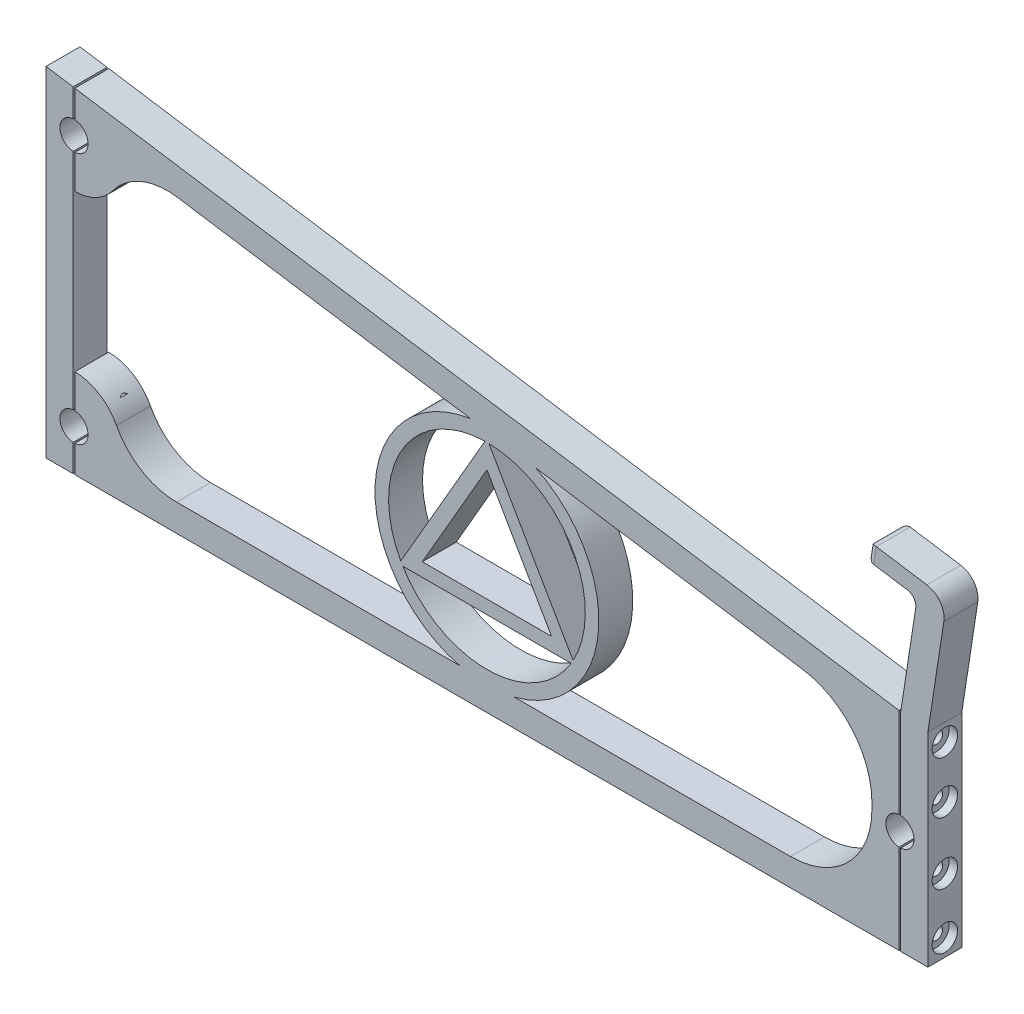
SolidWorks part; units mm, degrees
ref_plane "Front Plane" through (0, 0, 0) normal (0, 0, 1) x (1, 0, 0)
ref_plane "Top Plane" through (0, 0, 0) normal (0, 1, 0) x (1, 0, 0)
ref_plane "Right Plane" through (0, 0, 0) normal (1, 0, 0) x (0, 0, -1)
sketch "Sketch1" plane through (0, 0, 0) normal (0, 0, 1) x (1, 0, 0)
  line L0 (0, 0) -> (0, 100)
  line L1 (0, 100) -> (8, 98.7692)
  line L2 (260, 60) -> (260, 0)
  line L3 (260, 0) -> (252, 0)
  line L4 (130, 0) -> (130, 80) construction
  line L7 (243.5, 8) -> (21.7777, 8)
  line L9 (251.5, 0) -> (251.5, 26.4259)
  line L10 (252, 0) -> (252, 26.4259)
  line L11 (243.5, 54.4443) -> (243.5, 8)
  line L12 (251.5, 34.7108) -> (251.5, 61.3077)
  line L13 (252, 61.2308) -> (252, 34.7108)
  line L14 (8, 90.6751) -> (252, 53.1366) construction
  line L15 (252, 61.2308) -> (256.8658, 92.8587)
  line L16 (252, 53.1366) -> (252, 8) construction
  line L18 (264.5617, 89.6512) -> (260, 60)
  line L19 (256.8658, 92.8587) -> (242.0403, 95.1395)
  line L20 (252, 8) -> (8, 8) construction
  line L21 (251.5, 0) -> (8.5, 0)
  line L22 (260, 0) -> (0, 0) construction
  line L24 (0, 100) -> (260, 60) construction
  line L25 (242.0403, 95.1395) -> (242.8005, 100.0814)
  line L26 (242.8005, 100.0814) -> (265.6261, 96.5698)
  line L27 (265.6261, 96.5698) -> (264.5617, 89.6512)
  line L28 (8.5, 90.5906) -> (8.5, 98.6923)
  line L31 (8, 90.5906) -> (8, 98.7692)
  line L32 (8, 8) -> (8, 90.6751) construction
  line L33 (22.253, 88.4823) -> (243.5, 54.4443)
  line L34 (8.25, 12.15) -> (14.6026, 12.15) construction
  line L35 (8, 82.3057) -> (8, 16.2925)
  line L38 (8, 0) -> (0, 0)
  line L39 (8.5, 72.3004) -> (8.5, 82.3057)
  line L40 (8.5, 0) -> (8.5, 8.0075)
  line L41 (8.5, 98.6923) -> (251.5, 61.3077)
  line L42 (8.5, 16.2925) -> (8.5, 26.2978)
  line L43 (8, 8.0075) -> (8, 0)
  line L44 (8.25, 12.15) -> (251.5, 61.3077) construction
  arc A0 (251.5, 34.7108) -> (251.5, 26.4259) centre (251.75, 30.5683) ccw
  arc A1 (252, 26.4259) -> (252, 34.7108) centre (251.75, 30.5683) ccw
  arc A3 (8, 90.5906) -> (8, 82.3057) centre (8.25, 86.4482) ccw
  arc A4 (8.5, 82.3057) -> (8.5, 90.5906) centre (8.25, 86.4482) ccw
  arc A5 (22.253, 88.4823) -> (8.5, 72.3004) centre (8.25, 86.4482) cw
  arc A7 (21.7777, 8) -> (8.5, 26.2978) centre (8.25, 12.15) ccw
  arc A9 (8.5, 8.0075) -> (8.5, 16.2925) centre (8.25, 12.15) ccw
  arc A10 (8, 16.2925) -> (8, 8.0075) centre (8.25, 12.15) ccw
  dimension "D6" = 15
  dimension "D8" = 32
  dimension "D1" = 100
  dimension "D2" = 60
  dimension "D3" = 260
  dimension "D5" = 30
  dimension "D7" = 5
  dimension "D4" = 8
extrude "Boss-Extrude1" add sketch "Sketch1" along normal mid plane 10
fillet "Fillet1" radius 20 2 edges at (21.7777, 8, 0) (22.253, 88.4823, 0)
fillet "Fillet2" radius 24 2 edges at (243.5, 8, 0) (243.5, 54.4443, 0)
fillet "Fillet3" radius 3 1 edges at (256.8658, 92.8587, 0)
fillet "Fillet4" radius 6 1 edges at (265.6261, 96.5698, 0)
fillet "Fillet5" radius 2 4 edges at (242.8005, 100.0814, 0) (242.4204, 97.6105, 5) (242.0403, 95.1395, 0) (242.4204, 97.6105, -5)
ref_plane "Plane1" through (260, 0, 0) normal (1, 0, 0) x (0, 0, -1)
sketch "Sketch2" plane through (0, 0, 0) normal (0, 0, 1) x (1, 0, 0)
  line L0 (130, 0) -> (130, 80) construction
  line L1 (8.5, 0) -> (251.5, 0) construction
  line L2 (251.5, 61.3077) -> (8.5, 98.6923) construction
  line L3 (130, 62) -> (110.9474, 29)
  line L4 (129.4193, 68.9942) -> (104.5999, 26.0058)
  line L5 (105.1807, 25) -> (154.8193, 25)
  line L6 (155.4001, 26.0058) -> (130.5807, 68.9942)
  line L7 (110.9474, 29) -> (149.0526, 29)
  line L8 (149.0526, 29) -> (130, 62)
  line L9 (130, 70) -> (104.0192, 25) construction
  line L10 (155.9808, 25) -> (130, 70) construction
  line L11 (104.0192, 25) -> (155.9808, 25) construction
  circle A0 centre (130, 40) radius 33
  arc A1 (129.4193, 68.9942) -> (104.5999, 26.0058) centre (130, 40) ccw
  circle A2 centre (130, 40) radius 15 construction
  circle A3 centre (130, 40) radius 29 construction
  arc A4 (155.4001, 26.0058) -> (130.5807, 68.9942) centre (130, 40) ccw
  arc A5 (105.1807, 25) -> (154.8193, 25) centre (130, 40) ccw
  dimension "D1" = 4
  dimension "D2" = 4
extrude "Boss-Extrude2" add sketch "Sketch2" along normal mid plane 10
sketch "Sketch3" plane through (0, 0, 0) normal (1, 0, 0) x (0, 0, -1)
  line L2 (-5, 72.3004) -> (5, 72.3004) construction
  line L3 (-5, 16.2925) -> (5, 16.2925) construction
  line L4 (-5, 8.0075) -> (5, 8.0075) construction
  line L5 (-5, 26.2978) -> (5, 26.2978) construction
  line L6 (-5, 82.3057) -> (5, 82.3057) construction
  line L7 (-5, 90.5906) -> (5, 90.5906) construction
  line L8 (-5, 72.3004) -> (5, 72.3004) construction
  line L9 (-5, 90.5906) -> (5, 90.5906) construction
  line L10 (-5, 82.3057) -> (5, 82.3057) construction
  line L11 (-5, 26.2978) -> (5, 26.2978) construction
  line L12 (-5, 8.0075) -> (5, 8.0075) construction
  line L13 (-5, 16.2925) -> (5, 16.2925) construction
  line L16 (0, 90.5906) -> (0, 82.3057) construction
  line L17 (0, 82.3057) -> (0, 72.3004) construction
  line L18 (0, 72.3004) -> (0, 26.2978) construction
  line L19 (0, 26.2978) -> (0, 16.2925) construction
  line L20 (0, 16.2925) -> (0, 8.0075) construction
  line L21 (0, 8.0075) -> (0, 0) construction
  circle A0 centre (0, 94.0906) radius 1.5
  circle A1 centre (0, 77.3031) radius 1.5
  circle A2 centre (0, 21.2951) radius 1.5
  circle A3 centre (0, 4.0038) radius 1.5
  dimension "D1" = 3
  dimension "D2" = 3.5
extrude "Cut-Extrude1" cut sketch "Sketch3" along normal blind 18
sketch "Sketch4" plane through (0, 0, 0) normal (1, 0, 0) x (0, 0, -1)
  circle A0 centre (0, 94.0906) radius 1.875
  circle A1 centre (0, 77.3031) radius 1.875
  circle A2 centre (0, 21.2951) radius 1.875
  circle A3 centre (0, 4.0038) radius 1.875
  dimension "D1" = 3.75
extrude "Cut-Extrude2" cut sketch "Sketch4" along normal blind 8
sketch "Sketch5" plane through (0, 0, 0) normal (1, 0, 0) x (0, 0, -1)
  circle A0 centre (0, 94.0906) radius 3.75
  circle A3 centre (0, 77.3031) radius 3.75
  circle A4 centre (0, 21.2951) radius 3.75
  circle A5 centre (0, 4.0038) radius 3.75
  dimension "D1" = 7.5
extrude "Cut-Extrude3" cut sketch "Sketch5" along normal blind 2.5
sketch "Sketch7" plane through (260, 0, 0) normal (1, 0, 0) x (0, 0, -1)
  line L0 (-5, 26.4259) -> (5, 26.4259) construction
  line L1 (-5, 34.7108) -> (5, 34.7108) construction
  line L2 (-5, 26.4259) -> (5, 26.4259) construction
  line L3 (-5, 34.7108) -> (5, 34.7108) construction
  line L4 (0, 60) -> (0, 0) construction
  line L5 (-5, 60) -> (5, 60) construction
  line L6 (-5, 0) -> (5, 0) construction
  circle A0 centre (0, 55) radius 1.5
  circle A1 centre (0, 39.7108) radius 1.5
  circle A2 centre (0, 21.4259) radius 1.5
  circle A3 centre (0, 5) radius 1.5
  dimension "D1" = 3
  dimension "D2" = 5
  dimension "D3" = 5
  dimension "D4" = 5
  dimension "D5" = 5
extrude "Cut-Extrude4" cut sketch "Sketch7" against normal blind 21
sketch "Sketch8" plane through (260, 0, 0) normal (1, 0, 0) x (0, 0, -1)
  circle A0 centre (0, 55) radius 1.875
  circle A1 centre (0, 39.7108) radius 1.875
  circle A2 centre (0, 21.4259) radius 1.875
  circle A3 centre (0, 5) radius 1.875
  dimension "D1" = 3.75
extrude "Cut-Extrude5" cut sketch "Sketch8" against normal blind 8
sketch "Sketch9" plane through (260, 0, 0) normal (1, 0, 0) x (0, 0, -1)
  circle A0 centre (0, 55) radius 3.75
  circle A1 centre (0, 39.7108) radius 3.75
  circle A2 centre (0, 21.4259) radius 3.75
  circle A3 centre (0, 5) radius 3.75
  dimension "D1" = 7.5
extrude "Cut-Extrude6" cut sketch "Sketch9" against normal blind 2.5
